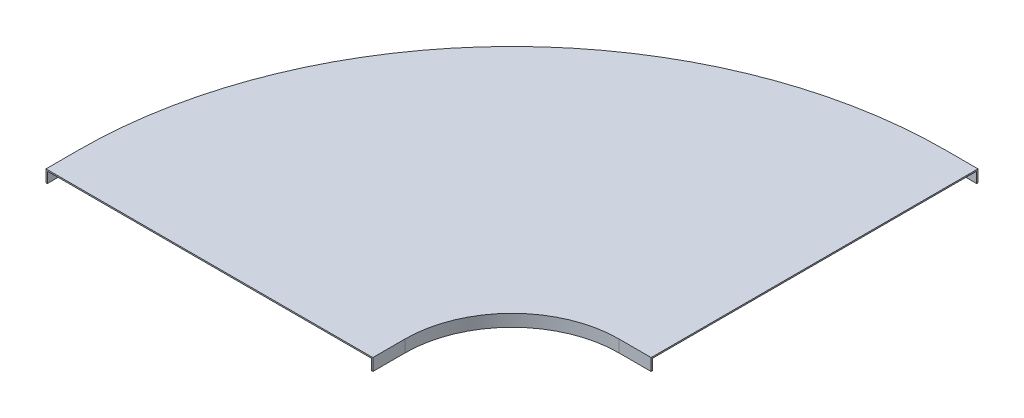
SolidWorks part; units mm, degrees
ref_plane "Front Plane" through (0, 0, 0) normal (0, 0, 1) x (1, 0, 0)
ref_plane "Top Plane" through (0, 0, 0) normal (0, 1, 0) x (1, 0, 0)
ref_plane "Right Plane" through (0, 0, 0) normal (1, 0, 0) x (0, 0, -1)
sketch "Sketch1" plane through (0, 0, 0) normal (0, 1, 0) x (1, 0, 0)
  line L1 (100, 130) -> (130, 130)
  line L5 (0, 0) -> (0, 30)
  arc A0 (0, 30) -> (100, 130) centre (100, 30) cw
  dimension "D2" = 100
  dimension "D1" = 30
sketch "Sketch3" plane through (0, 0, 0) normal (0, 0, 1) x (1, 0, 0)
  line L0 (0, 0) -> (0, -10)
  line L1 (0, 0) -> (-300, 0)
  line L2 (-300, 0) -> (-300, -10)
  line L3 (1.214, 1.214) -> (1.214, -10)
  line L4 (1.214, 1.214) -> (-301.214, 1.214)
  line L5 (-301.214, 1.214) -> (-301.214, -10)
  line L6 (1.214, 1.214) -> (1.214, -11.5185) construction
  line L10 (0, -10) -> (1.214, -10)
  line L11 (-300, -10) -> (-301.214, -10)
  line L12 (-301.214, 1.214) -> (-301.214, -11.5185) construction
  arc A4 (-300, -10) -> (-301.787, -17.1237) centre (-300, -13.786) cw construction
  arc A5 (0, -10) -> (1.787, -17.1237) centre (0, -13.786) ccw construction
  arc A6 (-301.214, -11.5185) -> (-301.214, -16.0535) centre (-300, -13.786) cw construction
  arc A7 (1.214, -11.5185) -> (1.214, -16.0535) centre (0, -13.786) ccw construction
  dimension "D1" = 10
  dimension "D3" = 302.428
  dimension "D2" = 1.214
sweep "Sweep1" add profiles "Sketch3" path "Sketch1"
